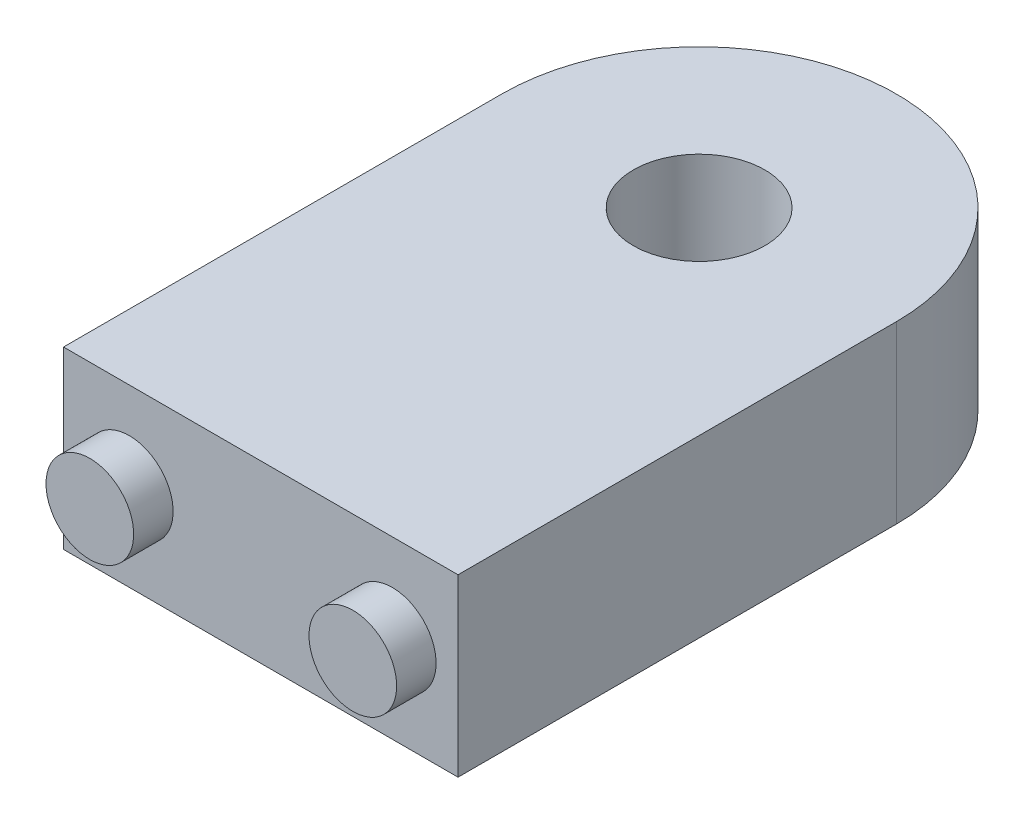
SolidWorks part; units mm, degrees
ref_plane "Front Plane" through (0, 0, 0) normal (0, 0, 1) x (1, 0, 0)
ref_plane "Top Plane" through (0, 0, 0) normal (0, 1, 0) x (1, 0, 0)
ref_plane "Right Plane" through (0, 0, 0) normal (1, 0, 0) x (0, 0, -1)
sketch "Sketch1" plane through (0, 0, 0) normal (0, 1, 0) x (1, 0, 0)
  line L1 (-225, -250) -> (225, -250)
  line L2 (-225, -250) -> (-225, 250)
  line L3 (-225, 250) -> (225, 250)
  line L4 (225, -250) -> (225, 250)
  line L5 (-225, -250) -> (225, 250) construction
  line L6 (-225, 250) -> (225, -250) construction
  arc A0 (-225, 250) -> (225, 250) centre (0, 250) cw
  point P0 (0, 0)
  dimension "D1" = 500
  dimension "D2" = 450
extrude "Boss-Extrude1" add sketch "Sketch1" along normal blind 200 contours A0 L3 | L1 L4 L3 L2
sketch "Sketch2" plane through (0, 200, 0) normal (0, 1, 0) x (1, 0, 0)
  line L0 (225, 250) -> (-225, 250)
  circle A0 centre (0, 250) radius 75
  dimension "D1" = 150
extrude "Cut-Extrude1" cut sketch "Sketch2" against normal through all contours A0
sketch "Sketch4" plane through (0, 0, 250) normal (0, 0, 1) x (1, 0, 0)
  line L0 (0, 0) -> (0, 200)
  line L1 (-225, 200) -> (225, 200) construction
  line L2 (0, 100) -> (150, 100)
  circle A0 centre (150, 100) radius 50
extrude "Boss-Extrude2" add sketch "Sketch4" along normal blind 45
sketch "Sketch5" plane through (0, 0, 250) normal (0, 0, 1) x (1, 0, 0)
  line L0 (0, 0) -> (0, 200)
  line L1 (-225, 200) -> (225, 200) construction
  line L2 (0, 100) -> (-150, 100)
  circle A0 centre (-150, 100) radius 50
  dimension "D1" = 150
extrude "Boss-Extrude3" add sketch "Sketch5" along normal blind 45
